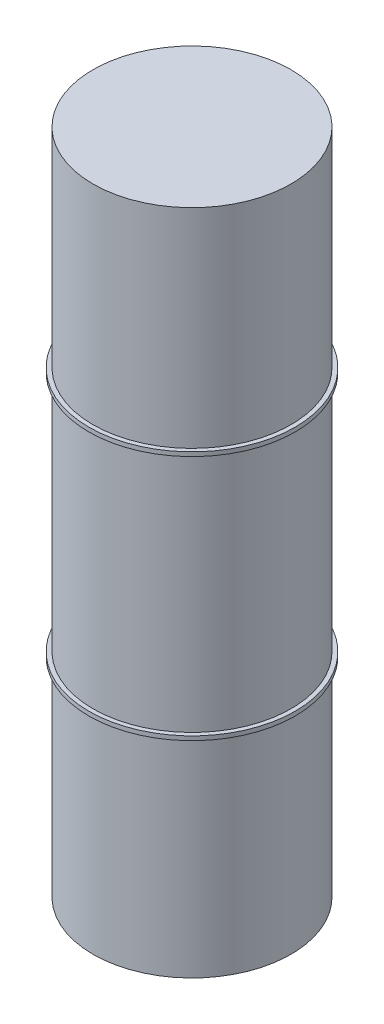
SolidWorks part; units mm, degrees
ref_plane "Front Plane" through (0, 0, 0) normal (0, 0, 1) x (1, 0, 0)
ref_plane "Top Plane" through (0, 0, 0) normal (0, 1, 0) x (1, 0, 0)
ref_plane "Right Plane" through (0, 0, 0) normal (1, 0, 0) x (0, 0, -1)
sketch "Sketch1" plane through (0, 0, 0) normal (0, 1, 0) x (1, 0, 0)
  circle A0 centre (0, 0) radius 4.75
  dimension "D1" = 9.5
extrude "Boss-Extrude1" add sketch "Sketch1" along normal blind 32
ref_plane "Plane1" through (0, 10, 0) normal (0, 1, 0) x (-1, 0, 0)
ref_plane "Plane2" through (0, 22, 0) normal (0, 1, 0) x (-1, 0, 0)
sketch "Sketch2" plane through (0, 10, 0) normal (0, 1, 0) x (-1, 0, 0)
  circle A0 centre (0, 0) radius 4.95
  circle A1 centre (0, 0) radius 4.75 construction
  dimension "D1" = 0.2
extrude "Boss-Extrude2" add sketch "Sketch2" along normal blind 0.2
sketch "Sketch3" plane through (0, 22, 0) normal (0, 1, 0) x (-1, 0, 0)
  circle A0 centre (0, 0) radius 4.95
  circle A1 centre (0, 0) radius 4.75 construction
  dimension "D1" = 0.2
extrude "Boss-Extrude3" add sketch "Sketch3" against normal blind 0.2
ref_plane "Plane3" through (0, 16, 0) normal (0, -1, 0) x (1, 0, 0)
